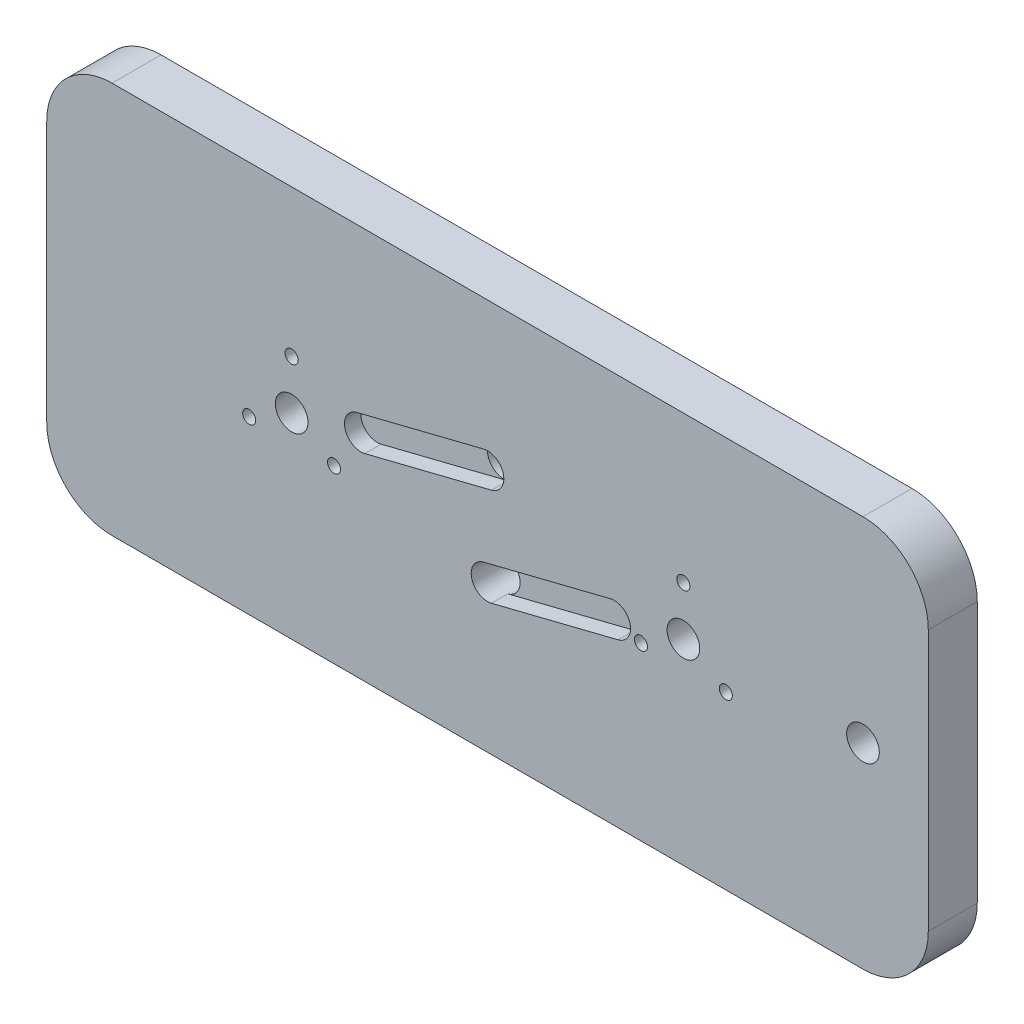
SolidWorks part; units mm, degrees
ref_plane "Plan de face" through (0, 0, 0) normal (0, 0, 1) x (1, 0, 0)
ref_plane "Plan de dessus" through (0, 0, 0) normal (0, 1, 0) x (1, 0, 0)
ref_plane "Plan de droite" through (0, 0, 0) normal (1, 0, 0) x (0, 0, -1)
sketch "Esquisse4" plane through (0, 0, 0) normal (0, 0, 1) x (1, 0, 0)
  line L0 (-6, 1.5) -> (-6, 0) construction
  line L1 (-11.5, -6) -> (11.5, -6)
  line L2 (-13.5, -4) -> (-13.5, 4)
  line L3 (-11.5, 6) -> (11.5, 6)
  line L4 (13.5, -4) -> (13.5, 4)
  line L5 (-13.5, -6) -> (13.5, 6) construction
  line L6 (-13.5, 6) -> (13.5, -6) construction
  line L7 (-6, 0) -> (-7.299, -0.75) construction
  line L8 (-6, 0) -> (-4.701, -0.75) construction
  line L9 (0, 3.26) -> (0, -4.2566) construction
  line L10 (6, 0) -> (4.701, -0.75) construction
  line L11 (6, 0) -> (7.299, -0.75) construction
  line L12 (6, 1.5) -> (6, 0) construction
  arc A0 (-11.5, -6) -> (-13.5, -4) centre (-11.5, -4) cw
  arc A1 (11.5, -6) -> (13.5, -4) centre (11.5, -4) ccw
  arc A2 (11.5, 6) -> (13.5, 4) centre (11.5, 4) cw
  arc A3 (-13.5, 4) -> (-11.5, 6) centre (-11.5, 4) cw
  circle A4 centre (0, 1.5) radius 0.5
  circle A5 centre (0, -1.5) radius 0.5
  circle A6 centre (-6, 1.5) radius 0.2
  circle A7 centre (-7.299, -0.75) radius 0.2
  circle A8 centre (-4.701, -0.75) radius 0.2
  circle A9 centre (4.701, -0.75) radius 0.2
  circle A10 centre (7.299, -0.75) radius 0.2
  circle A11 centre (6, 1.5) radius 0.2
  circle A12 centre (6, 0) radius 0.5
  circle A13 centre (-6, 0) radius 0.5
  circle A14 centre (11.5, 0) radius 0.5
  point P0 (0, 0)
  point P22 (-6, 0)
  dimension "D3" = 2
  dimension "D4" = 1.5
  dimension "D7" = 1.5
  dimension "D12" = 11.5
  dimension "D1" = 12
  dimension "D2" = 27
  dimension "D5" = 1.5
  dimension "D6" = 6
  dimension "D8" = 1.5
  dimension "D9" = 1.5
  dimension "D10" = 120
  dimension "D11" = 120
extrude "Boss.-Extru.3" add sketch "Esquisse4" along normal blind 1.5
sketch "Esquisse6" plane through (0, 0, 1.5) normal (0, 0, 1) x (1, 0, 0)
  line L0 (0, 1.5) -> (-6, 0) construction
  line L1 (0, -1.5) -> (6, 0) construction
  line L2 (0, 1.5) -> (-3.8806, 0.5299) construction
  line L3 (0.1213, 1.0149) -> (-3.7593, 0.0448)
  line L4 (-0.1213, 1.9851) -> (-4.0018, 1.0149)
  line L5 (0, -1.5) -> (3.8806, -0.5299) construction
  line L6 (-0.1213, -1.0149) -> (3.7593, -0.0448)
  line L7 (0.1213, -1.9851) -> (4.0018, -1.0149)
  arc A0 (0.1213, 1.0149) -> (-0.1213, 1.9851) centre (0, 1.5) ccw
  arc A1 (-4.0018, 1.0149) -> (-3.7593, 0.0448) centre (-3.8806, 0.5299) ccw
  arc A2 (-0.1213, -1.0149) -> (0.1213, -1.9851) centre (0, -1.5) ccw
  arc A3 (4.0018, -1.0149) -> (3.7593, -0.0448) centre (3.8806, -0.5299) ccw
  point P8 (-1.9403, 1.0149)
  point P14 (1.9403, -1.0149)
extrude "Enlèv. mat.-Extru.1" cut sketch "Esquisse6" against normal blind 0.5
sketch "Esquisse7" plane through (0, 0, 0) normal (0, 0, -1) x (-1, 0, 0)
  circle A0 centre (0, 0) radius 3
  circle A1 centre (0, 0) radius 3.5
extrude "Boss.-Extru.4" add sketch "Esquisse7" along normal blind 1
